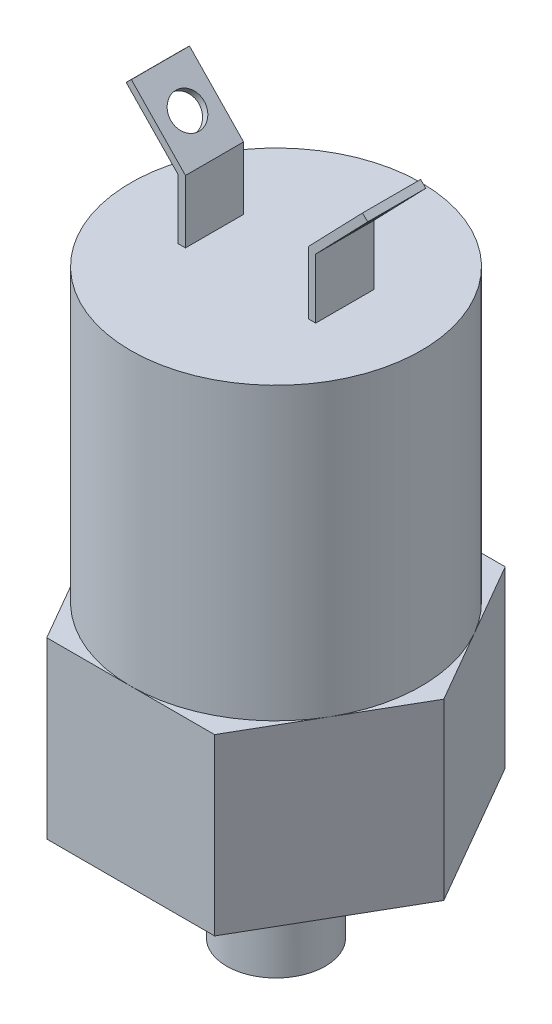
SolidWorks part; units mm, degrees
ref_plane "Front Plane" through (0, 0, 0) normal (0, 0, 1) x (1, 0, 0)
ref_plane "Top Plane" through (0, 0, 0) normal (0, 1, 0) x (1, 0, 0)
ref_plane "Right Plane" through (0, 0, 0) normal (1, 0, 0) x (0, 0, -1)
sketch "Sketch2" plane through (0, 0, 0) normal (0, 1, 0) x (1, 0, 0)
  line L0 (0, 0) -> (0, 12.7) construction
  line L1 (7.3323, 12.7) -> (-7.3323, 12.7)
  line L2 (-7.3323, 12.7) -> (-14.6647, 0)
  line L3 (-14.6647, 0) -> (-7.3323, -12.7)
  line L4 (-7.3323, -12.7) -> (7.3323, -12.7)
  line L5 (7.3323, -12.7) -> (14.6647, 0)
  line L6 (14.6647, 0) -> (7.3323, 12.7)
  circle A0 centre (0, 0) radius 12.7 construction
  dimension "D1" = 25.4
extrude "Boss-Extrude1" add sketch "Sketch2" along normal blind 15.24
sketch "Sketch3" plane through (0, 15.24, 0) normal (0, 1, 0) x (1, 0, 0)
  circle A0 centre (0, 0) radius 12.7
  dimension "D1" = 25.4
extrude "Boss-Extrude2" add sketch "Sketch3" along normal blind 25.4
sketch "Sketch4" plane through (0, 0, 0) normal (0, -1, 0) x (1, 0, 0)
  circle A0 centre (0, 0) radius 4.3053
  dimension "D1" = 8.6106
extrude "Boss-Extrude3" add sketch "Sketch4" along normal blind 10.16
sketch "Sketch5" plane through (0, 0, 0) normal (0, 0, 1) x (1, 0, 0)
  line L0 (5.6907, 40.64) -> (5.6907, 45.9952)
  line L1 (12.7, 40.64) -> (-12.7, 40.64) construction
  line L2 (5.6907, 45.9952) -> (10.3268, 50.8)
  dimension "D1" = 10.16
extrude "Extrude-Thin1" add sketch "Sketch5" along normal mid plane 5.08 thin
sketch "Sketch6" plane through (-20.2644, 19.5529, 0) normal (-0.7196, 0.6944, 0) x (0, 0, 1)
  line L1 (2.54, 43.7276) -> (-2.54, 43.7276) construction
  line L2 (0, 40.3251) -> (0, 43.7276) construction
  line L3 (0, 40.3251) -> (-2.54, 40.3251) construction
  line L4 (-2.54, 36.9226) -> (-2.54, 43.7276) construction
  circle A0 centre (0, 40.3251) radius 1.4605
  dimension "D1" = 2.921
extrude "Cut-Extrude1" cut sketch "Sketch6" against normal up to next
mirror "Mirror1" about plane through (0, 0, 0) normal (1, 0, 0) of "Extrude-Thin1", "Cut-Extrude1"
